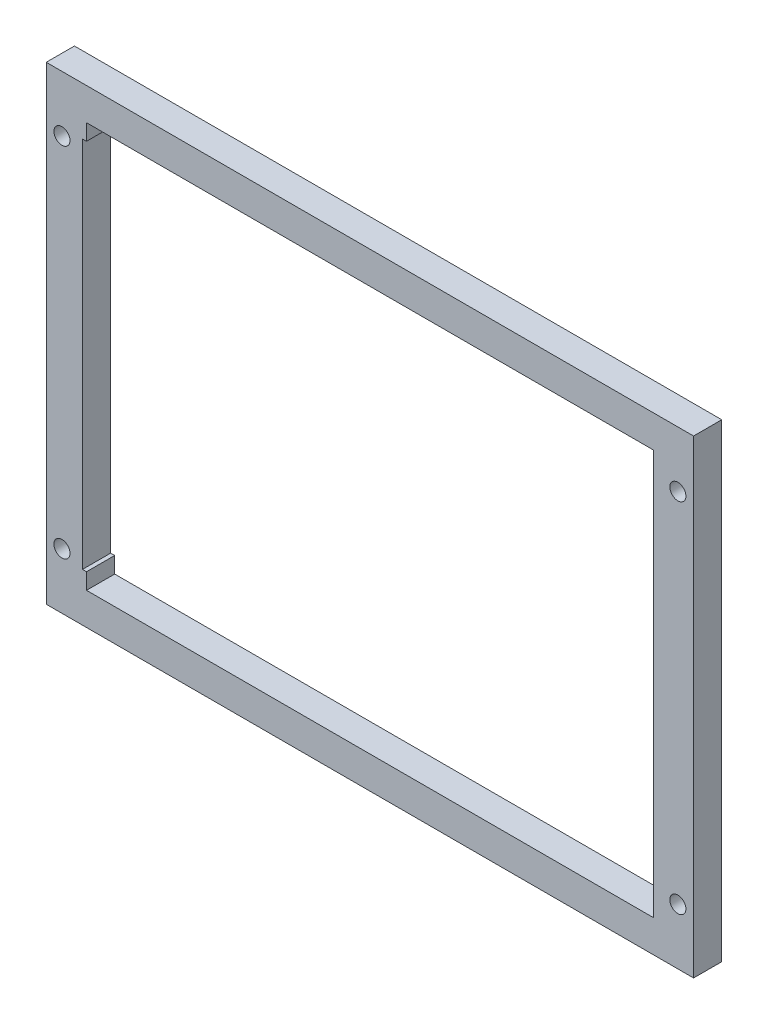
SolidWorks part; units mm, degrees
ref_plane "Front Plane" through (0, 0, 0) normal (0, 0, 1) x (1, 0, 0)
ref_plane "Top Plane" through (0, 0, 0) normal (0, 1, 0) x (1, 0, 0)
ref_plane "Right Plane" through (0, 0, 0) normal (1, 0, 0) x (0, 0, -1)
sketch "Esquisse1" plane through (0, 0, 0) normal (0, 0, 1) x (1, 0, 0)
  line L0 (-38.25, 22.2) -> (38.25, 22.2) construction
  line L1 (-35.2, 25.15) -> (35.2, 25.15)
  line L2 (-35.2, 25.15) -> (-35.2, 23.15)
  line L3 (-35.2, -25.15) -> (35.2, -25.15)
  line L4 (35.2, 25.15) -> (35.2, -25.15)
  line L5 (-40.2, 29.15) -> (40.2, 29.15)
  line L6 (-40.2, 29.15) -> (-40.2, -29.15)
  line L7 (-40.2, -29.15) -> (40.2, -29.15)
  line L8 (40.2, 29.15) -> (40.2, -29.15)
  line L9 (-38.25, 22.2) -> (-38.25, -22.2) construction
  line L10 (-35.2, 23.15) -> (-35.7, 23.15)
  line L11 (-35.7, 23.15) -> (-35.7, -23.15)
  line L12 (-35.7, -23.15) -> (-35.2, -23.15)
  line L13 (-35.2, -23.15) -> (-35.2, -25.15)
  circle A0 centre (-38.25, 22.2) radius 1
  circle A1 centre (-38.25, -22.2) radius 1
  circle A2 centre (38.25, 22.2) radius 1
  circle A3 centre (38.25, -22.2) radius 1
  point P10 (-35.7, 0)
  point P18 (-38.25, 0)
  point P19 (0, 22.2)
  point P20 (0, -25.15)
  point P23 (0, 25.15)
  point P27 (35.2, 0)
extrude "Boss.-Extru.1" add sketch "Esquisse1" along normal blind 3.5
equation "\"D2@Esquisse1\"=\"D1@Esquisse1\""
equation "\"D4@Esquisse1\"=\"D3@Esquisse1\""
